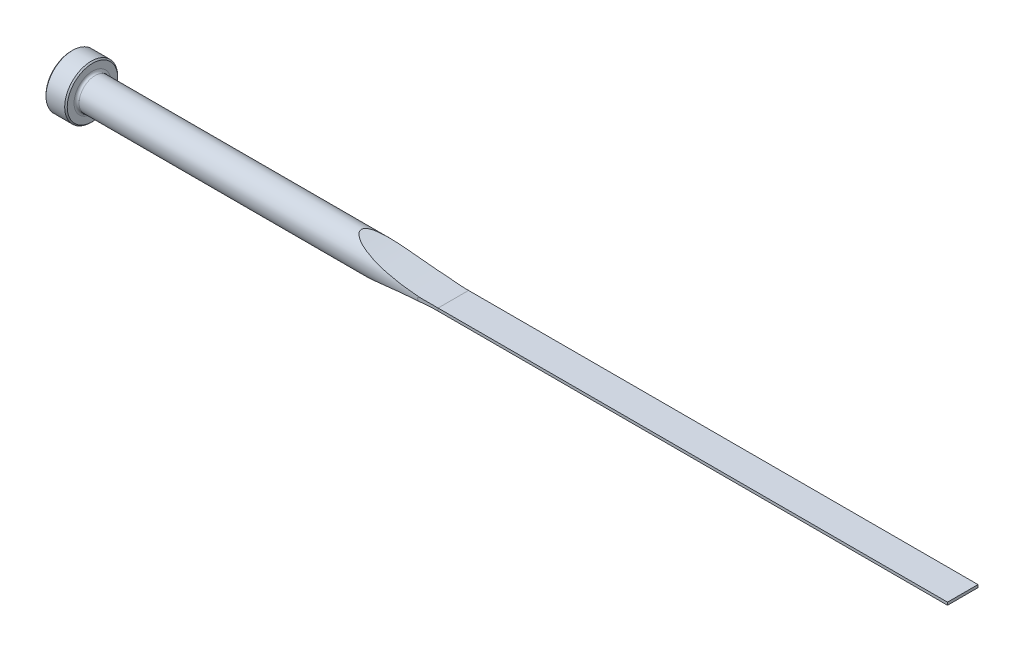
SolidWorks part; units mm, degrees
ref_plane "Front Plane" through (0, 0, 0) normal (0, 0, 1) x (1, 0, 0)
ref_plane "Top Plane" through (0, 0, 0) normal (0, 1, 0) x (1, 0, 0)
ref_plane "Right Plane" through (0, 0, 0) normal (1, 0, 0) x (0, 0, -1)
sketch "Sketch1" plane through (0, 0, 0) normal (0, 0, 1) x (1, 0, 0)
  line L0 (0, 0) -> (175.5286, 0) construction
  line L1 (0, 0) -> (0, 7.9375)
  line L2 (0, 7.9375) -> (6.35, 7.9375)
  line L3 (6.35, 7.9375) -> (6.35, 4.7625)
  line L4 (6.35, 4.7625) -> (266.7, 4.7625)
  line L5 (266.7, 4.7625) -> (266.7, 0)
  line L6 (266.7, 0) -> (0, 0)
  dimension "D1" = 266.7
  dimension "D2" = 15.875
  dimension "D3" = 9.525
  dimension "D4" = 6.35
revolve "Revolve1" add sketch "Sketch1" angle 360 about L0
sketch "Sketch2" plane through (0, 0, 0) normal (0, 0, 1) x (1, 0, 0)
  line L0 (266.7, 4.7625) -> (266.7, 0.4064)
  line L1 (266.7, -4.7625) -> (266.7, 4.7625) construction
  line L2 (266.7, 0.4064) -> (114.3, 0.4064)
  line L3 (266.7, 4.7625) -> (6.35, 4.7625) construction
  line L4 (86.8129, 4.7625) -> (266.7, 4.7625)
  line L5 (166.0833, 0) -> (153.1705, 0) construction
  arc A0 (114.3, 0.4064) -> (86.8129, 4.7625) centre (114.3, 89.3064) cw
  dimension "D1" = 88.9
  dimension "D3" = 152.4
  dimension "D2" = 0.8128
  dimension "D4" = 27.4871
extrude "Cut-Extrude1" cut sketch "Sketch2" against normal through all both and the other way through all
mirror "Mirror1" about plane through (0, 0, 0) normal (0, 1, 0) of "Cut-Extrude1"
sketch "Sketch3" plane through (0, 0, 0) normal (0, 1, 0) x (1, 0, 0)
  line L0 (266.7, 4.7625) -> (266.7, 4.5593)
  line L1 (266.7, 4.7451) -> (266.7, -4.7451) construction
  line L2 (266.7, 4.5593) -> (114.3, 4.5593)
  line L3 (266.7, 4.7625) -> (6.35, 4.7625) construction
  line L4 (108.2927, 4.7625) -> (266.7, 4.7625)
  line L5 (163.4716, 0) -> (166.2513, 0) construction
  line L6 (114.3, 4.7451) -> (114.3, -4.7451) construction
  arc A0 (114.3, 4.5593) -> (108.2927, 4.7625) centre (114.3, 93.4593) cw
  dimension "D2" = 88.9
  dimension "D1" = 9.1186
extrude "Cut-Extrude2" cut sketch "Sketch3" against normal through all both and the other way through all
mirror "Mirror2" about plane through (0, 0, 0) normal (0, 0, 1) of "Cut-Extrude2"
fillet "Fillet1" radius 0.762 1 edges at (6.35, 0, 4.7625)
chamfer "Chamfer1" distance 0.381 angle 45 2 edges at (0, 0, 7.9375) (6.35, 0, 7.9375)
